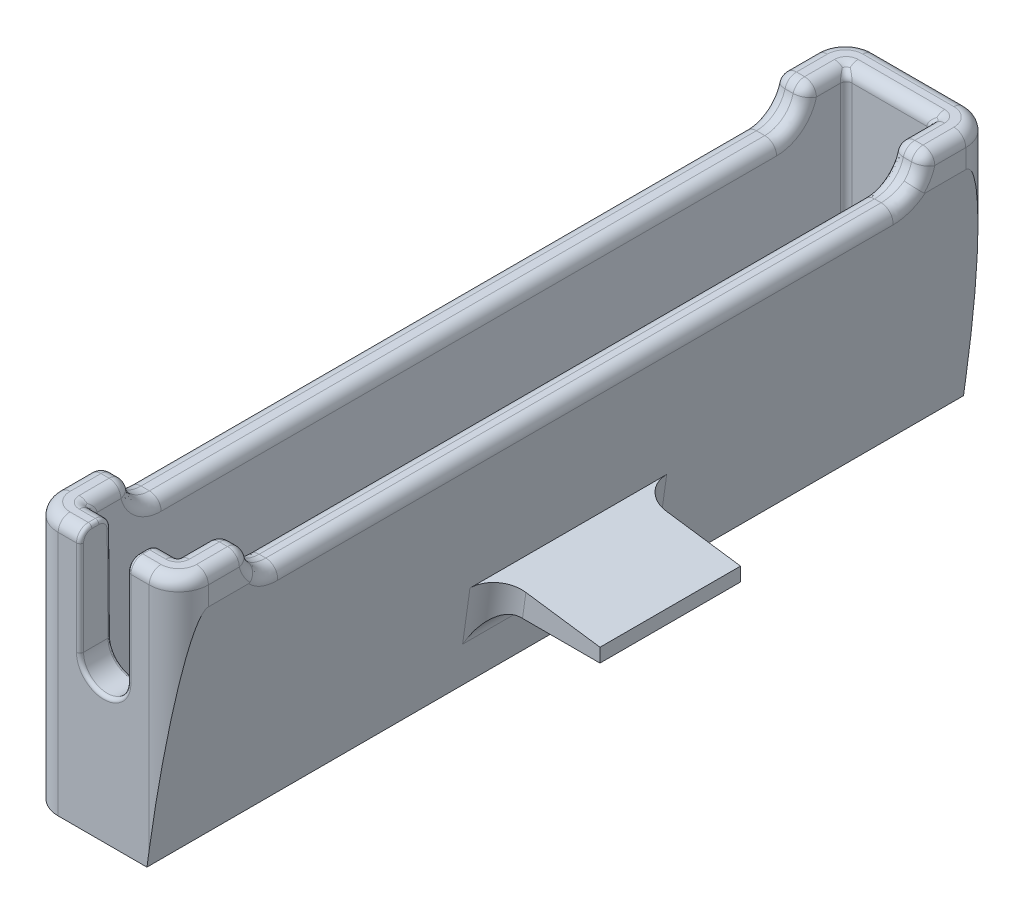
SolidWorks part; units mm, degrees
other "<Bottom_Left>-<Draft1>"
other "<Base_Ramp>-<Boss-Extrude4>"
other "<Bottom_Right>-<Draft1>"
other "<Middle_Left>-<Cut-Extrude2>"
other "<Middle_Right>-<Cut-Extrude2>"
other "<Top_Left>-<Cut-Extrude2>"
other "<Top_Right>-<Cut-Extrude3>"
ref_plane "Front Plane" through (0, 0, 0) normal (0, 0, 1) x (1, 0, 0)
ref_plane "Top Plane" through (0, 0, 0) normal (0, 1, 0) x (1, 0, 0)
ref_plane "Right Plane" through (0, 0, 0) normal (1, 0, 0) x (0, 0, -1)
inserted part "Bottom_Left"
move or copy body "Body-Move/Copy2" placed by mates yes
other "Angle2" parameters "D1"=8
inserted part "Base_Ramp"
move or copy body "Body-Move/Copy5" placed by mates yes
other "Distance1" parameters "D1"=12.5
inserted part "Bottom_Right"
move or copy body "Body-Move/Copy8" placed by mates yes
inserted part "Middle_Left"
move or copy body "Body-Move/Copy10" placed by mates yes
inserted part "Middle_Right"
move or copy body "Body-Move/Copy12" placed by mates yes
inserted part "Top_Left"
move or copy body "Body-Move/Copy14" placed by mates yes
inserted part "Top_Right"
move or copy body "Body-Move/Copy16" placed by mates yes
combine bodies "Combine1" operation type add bodies to combine 105 101 103 119 121 120 122
sketch "Sketch3" plane through (0, 0, 0) normal (0, 1, 0) x (1, 0, 0)
  line L1 (-159.5768, 191.406) -> (-184.9575, 191.406)
  line L2 (-159.5768, 191.406) -> (-159.5768, 53.406)
  line L3 (-159.5768, 53.406) -> (-184.9575, 53.406)
  line L4 (-184.9575, 191.406) -> (-184.9575, 53.406)
  line L8 (-162.7082, 134.906) -> (-162.7082, 109.906) construction
  line L10 (-159.5768, 274.906) -> (-159.5768, -30.094) construction
  line L11 (-164.9575, 222.406) -> (-164.9575, 22.406) construction
  point P6 (-184.9575, 122.406)
  point P12 (-162.7082, 122.406)
  dimension "D1" = 20
  dimension "D2" = 138
extrude "Boss-Extrude1" add sketch "Sketch3" along normal blind 43.5 separate body
sketch "Sketch4" plane through (-159.5768, 0, 0) normal (1, 0, 0) x (0, 0, -1)
  line L1 (91.7769, 4.6931) -> (160.7382, 4.6931)
  line L2 (91.7769, 4.6931) -> (91.7769, 25.2347)
  line L3 (91.7769, 25.2347) -> (160.7382, 25.2347)
  line L4 (160.7382, 4.6931) -> (160.7382, 25.2347)
  line L5 (91.7769, 4.6931) -> (160.7382, 25.2347) construction
  line L6 (91.7769, 25.2347) -> (160.7382, 4.6931) construction
  point P0 (126.2575, 14.9639)
extrude "Boss-Extrude2" add sketch "Sketch4" along normal blind 15
combine bodies "Combine2" operation type subtract main body 109 bodies to subtract 107
delete or keep bodies "Body-Delete/Keep 1" type delete bodies bodies 124 125 110 123 111 127
sketch "Sketch5" plane through (-0.9457, -6.7293, 0) normal (0.1392, 0.9903, 0) x (0.9903, -0.1392, 0)
  line L0 (-163.3522, 191.406) -> (-163.3522, 53.406) construction
  line L1 (-163.3522, 146.8422) -> (-145.6833, 146.8422)
  line L2 (-163.3522, 146.8422) -> (-163.3522, 96.0052)
  line L3 (-163.3522, 96.0052) -> (-145.6833, 96.0052)
  line L4 (-145.6833, 146.8422) -> (-145.6833, 96.0052)
extrude "Cut-Extrude1" cut sketch "Sketch5" along normal blind 15
ref_plane "Plane1" through (-161.7624, 22.7342, 0) normal (0.9903, -0.1392, 0) x (0, 0, -1)
sketch "Sketch6" plane through (-161.7624, 22.7342, 0) normal (0.9903, -0.1392, 0) x (0, 0, -1)
  line L0 (122.406, -6.7955) -> (122.406, -16.191) construction
  line L7 (104.906, -16.191) -> (139.906, -16.191) construction
  line L10 (139.906, -6.7955) -> (104.906, -6.7955) construction
  point P7 (122.406, -11.4932)
split "Split1" trim tools "Plane1" bodies to split 108 resulting bodies 113 114
scale "Scale1"
combine bodies "Combine3" operation type add bodies to combine 114 115
sketch "Sketch7" plane through (0, 43.5, 0) normal (0, 1, 0) x (1, 0, 0)
  line L0 (-159.5768, 53.406) -> (-159.5768, 191.406) construction
  line L1 (-179.2672, 58.906) -> (-165.2672, 58.906)
  line L2 (-179.2672, 58.906) -> (-179.2672, 185.906)
  line L3 (-179.2672, 185.906) -> (-165.2672, 185.906)
  line L4 (-165.2672, 58.906) -> (-165.2672, 185.906)
  line L5 (-179.2672, 58.906) -> (-165.2672, 185.906) construction
  line L6 (-179.2672, 185.906) -> (-165.2672, 58.906) construction
  line L7 (-159.5768, 191.406) -> (-184.9575, 191.406) construction
  point P0 (-172.2672, 122.406)
  point P8 (-159.5768, 122.406)
  point P11 (-172.2672, 191.406)
  dimension "D1" = 14
  dimension "D2" = 127
extrude "Cut-Extrude2" cut sketch "Sketch7" against normal blind 38.5 contours L4 L3 L2 L1
draft "Draft1" type of draft neutral plane draft angle 0.5 faces to draft 4 parameters "D1"=0.5
sketch "Sketch8" plane through (-159.5768, 0, 0) normal (1, 0, 0) x (0, 0, -1)
  line L0 (53.406, 43.5) -> (191.406, 43.5) construction
  line L1 (65.406, 43.5) -> (179.406, 43.5)
  line L2 (65.406, 43.5) -> (65.406, 38.2859)
  line L3 (65.406, 38.2859) -> (179.406, 38.2859)
  line L4 (179.406, 43.5) -> (179.406, 38.2859)
  line L5 (191.406, 38.2859) -> (53.406, 38.2859) construction
  line L6 (53.406, 43.5) -> (53.406, 38.2859) construction
  line L7 (191.406, 43.5) -> (191.406, 38.2859) construction
  dimension "D1" = 12
  dimension "D2" = 12
extrude "Cut-Extrude3" cut sketch "Sketch8" against normal through all
fillet "Fillet1" radius 5 8 edges at (-162.2767, 38.2859, -179.406) (-182.2576, 38.2859, -179.406) (-182.2576, 38.2859, -65.406) (-162.2767, 38.2859, -65.406) (-184.9575, 21.75, -53.406) (-184.9575, 21.75, -191.406) (-159.5768, 40.893, -191.406) (-159.5768, 40.893, -53.406)
fillet "Fillet3" radius 2 20 edges at (-172.2672, 43.5, -191.406) (-172.2672, 43.5, -53.406) (-172.2672, 43.5, -58.57) (-172.2672, 43.5, -186.242) (-164.9312, 43.5, -61.988) (-164.9312, 43.5, -182.824) (-179.6031, 43.5, -61.988) (-179.6031, 43.5, -182.824) (-159.5768, 43.5, -182.906) (-161.0413, 43.5, -189.9415) (-184.9575, 43.5, -182.906) (-183.4931, 43.5, -189.9415) (-184.9575, 43.5, -61.906) (-183.4931, 43.5, -54.8705) (-159.5768, 43.5, -61.906) (-161.0413, 43.5, -54.8705) (-182.2803, 43.5, -65.406) (-162.254, 43.5, -65.406) (-182.2803, 43.5, -179.406) (-162.254, 43.5, -179.406)
fillet "Fillet4" radius 2 27 edges at (-164.9689, 39.1724, -177.2483) (-184.9575, 39.1671, -177.2406) (-179.5654, 39.1724, -67.5637) (-159.5768, 39.1671, -67.5714) (-159.5768, 39.1671, -177.2406) (-179.5654, 39.1724, -177.2483) (-184.9575, 39.1671, -67.5714) (-164.9689, 39.1724, -67.5637) (-180.3652, 43.0844, -179.9538) (-184.1781, 43.0844, -179.9538) (-164.1691, 43.0844, -179.9538) (-160.3562, 43.0844, -179.9538) (-164.1691, 43.0844, -64.8582) (-160.3562, 43.0844, -64.8582) (-180.3652, 43.0844, -64.8582) (-184.1781, 43.0844, -64.8582) (-164.9767, 38.2859, -122.406) (-179.5576, 38.2859, -122.406) (-184.9575, 38.2859, -122.406)
fillet "Fillet5" radius 1 4 edges at (-165.1078, 23.2587, -186.0653) (-179.4265, 23.2587, -186.0653) (-165.1078, 23.2587, -58.7466) (-179.4265, 23.2587, -58.7466)
sketch "Sketch9" plane through (0, 0, -53.406) normal (0, 0, 1) x (1, 0, 0)
  line L0 (-176.2672, 43.5) -> (-168.2672, 43.5)
  line L1 (-179.9575, 43.5) -> (-164.5768, 43.5) construction
  line L2 (-176.2672, 43.5) -> (-176.2672, 25.5)
  line L3 (-168.2672, 25.5) -> (-168.2672, 43.5)
  arc A0 (-176.2672, 25.5) -> (-168.2672, 25.5) centre (-172.2672, 25.5) ccw
  point P4 (-172.2672, 43.5)
  point P5 (-172.2672, 43.5)
  dimension "D1" = 8
  dimension "D2" = 18
extrude "Cut-Extrude4" cut sketch "Sketch9" against normal up to next
fillet "Fillet6" radius 0.6 12 edges at (-172.2672, 21.5, -58.762) (-168.2672, 33.5087, -58.6572) (-168.2672, 42.9204, -57.9954) (-168.2672, 43.5, -55.9967) (-168.2672, 42.9142, -53.9918) (-168.2672, 33.5, -53.406) (-172.2672, 21.5, -53.406) (-176.2672, 33.5, -53.406) (-176.2672, 42.9142, -53.9918) (-176.2672, 43.5, -55.9967) (-176.2672, 42.9204, -57.9954) (-176.2672, 33.5087, -58.6572)
equation "\"38.5mn\"=15"
